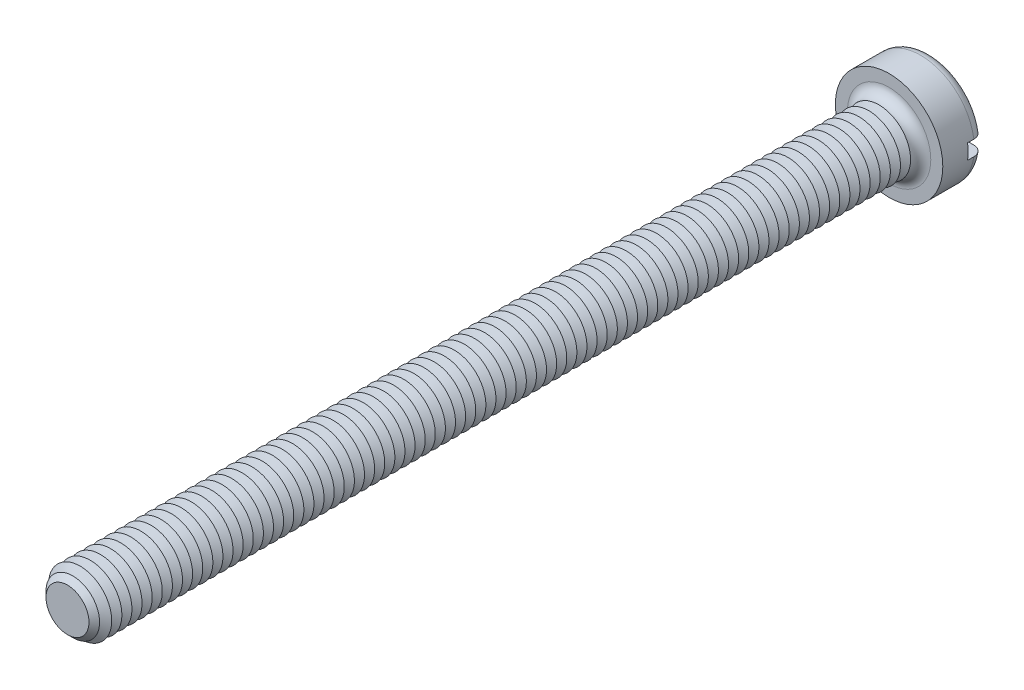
SolidWorks part; units mm, degrees
ref_plane "Front Plane" through (0, 0, 0) normal (0, 0, 1) x (1, 0, 0)
ref_plane "Top Plane" through (0, 0, 0) normal (0, 1, 0) x (1, 0, 0)
ref_plane "Right Plane" through (0, 0, 0) normal (1, 0, 0) x (0, 0, -1)
sketch "Sketch3" plane through (0, 0, 0) normal (0, 0, 1) x (1, 0, 0)
  circle A0 centre (0, 0) radius 4.25
  dimension "D1" = 8.5
extrude "Boss-Extrude2" add sketch "Sketch3" against normal blind 3.3
sketch "Sketch4" plane through (0, 0, 0) normal (0, 0, 1) x (1, 0, 0)
  circle A0 centre (0, 0) radius 2.5
  dimension "D1" = 5
extrude "Boss-Extrude3" add sketch "Sketch4" along normal blind 65
fillet "Fillet1" radius 0.8 2 edges at (4.25, 0, -3.3) (2.5, 0, 0)
chamfer "Chamfer1" distance 0.8 angle 45 1 edges at (2.5, 0, 65)
sketch "Sketch5" plane through (0, 0, 0) normal (1, 0, 0) x (0, 0, -1)
  line L0 (1.6944, 0) -> (-7.6738, 0) construction
sketch "Sketch6" plane through (0, 0, 0) normal (1, 0, 0) x (0, 0, -1)
  line L0 (-0.8, 2.5) -> (-1.2, 1.8072)
  line L1 (-1.2, 1.8072) -> (-1.6, 2.5)
  line L2 (-0.8, 2.5) -> (-64.2, 2.5) construction
  line L3 (-1.6, 2.5) -> (-0.8, 2.5)
  dimension "D1" = 0.8
revolve "Cut-Revolve1" cut sketch "Sketch6" angle 360 about L0
pattern_linear "LPattern1" count 80 spacing 0.8 along (0, 0, 1) of "Cut-Revolve1"
sketch "Sketch8" plane through (0, 0, -3.3) normal (0, 0, -1) x (-1, 0, 0)
  line L1 (4.25, -0.6) -> (-4.25, -0.6)
  line L2 (4.25, -0.6) -> (4.25, 0.6)
  line L3 (4.25, 0.6) -> (-4.25, 0.6)
  line L4 (-4.25, -0.6) -> (-4.25, 0.6)
  line L5 (4.25, -0.6) -> (-4.25, 0.6) construction
  line L6 (4.25, 0.6) -> (-4.25, -0.6) construction
  point P0 (0, 0)
  dimension "D1" = 8.5
  dimension "D2" = 1.2
extrude "Cut-Extrude1" cut sketch "Sketch8" against normal blind 1.3
